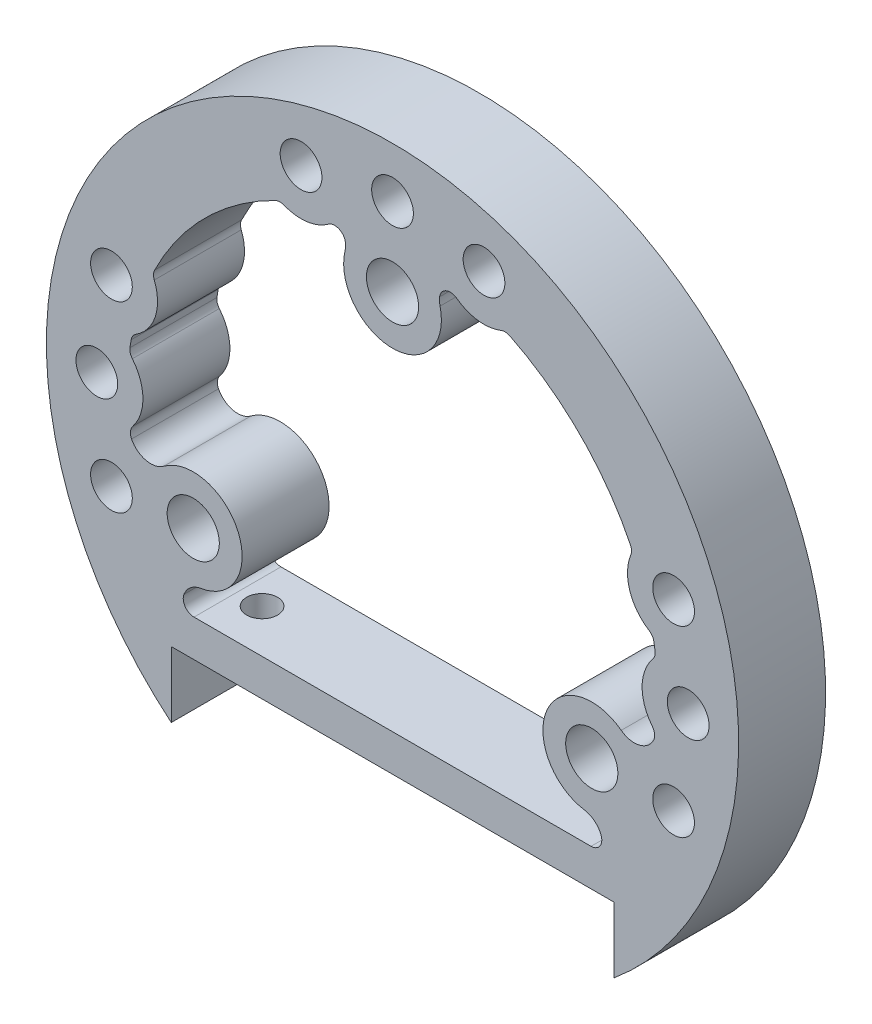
SolidWorks part; units mm, degrees
ref_plane "Front Plane" through (0, 0, 0) normal (0, 0, 1) x (1, 0, 0)
ref_plane "Top Plane" through (0, 0, 0) normal (0, 1, 0) x (1, 0, 0)
ref_plane "Right Plane" through (0, 0, 0) normal (1, 0, 0) x (0, 0, -1)
sketch "Sketch1" plane through (0, 0, 0) normal (0, 0, 1) x (1, 0, 0)
  circle A0 centre (0, 0) radius 25.273
  dimension "D1" = 50.546
extrude "Boss-Extrude1" add sketch "Sketch1" along normal blind 6.35
sketch "Sketch2" plane through (0, 0, 6.35) normal (0, 0, 1) x (1, 0, 0)
  line L0 (-15.2507, -11.938) -> (15.2507, -11.938)
  arc A0 (15.2507, -11.938) -> (-15.2507, -11.938) centre (0, 0) ccw
  dimension "D1" = 38.735
  dimension "D2" = 11.938
extrude "Cut-Extrude1" cut sketch "Sketch2" against normal through all
sketch "Sketch3" plane through (0, 0, 6.35) normal (0, 0, 1) x (1, 0, 0)
  line L0 (-15.2507, -11.938) -> (15.2507, -11.938) construction
  line L1 (-16.1544, -33.6804) -> (16.1544, -33.6804)
  line L2 (-16.1544, -33.6804) -> (-16.1544, -14.6304)
  line L3 (-16.1544, -14.6304) -> (16.1544, -14.6304)
  line L4 (16.1544, -33.6804) -> (16.1544, -14.6304)
  dimension "D1" = 2.6924
  dimension "D2" = 32.3088
  dimension "D3" = 16.1544
  dimension "D4" = 19.05
extrude "Cut-Extrude3" cut sketch "Sketch3" against normal through all
sketch "Sketch4" plane through (0, -14.6304, 0) normal (0, -1, 0) x (1, 0, 0)
  line L0 (16.1544, 6.35) -> (-16.1544, 6.35) construction
  circle A0 centre (-12.7, 3.175) radius 1.1303
  circle A1 centre (12.7, 3.175) radius 1.1303
  dimension "D1" = 2.2606
  dimension "D2" = 2.2606
  dimension "D4" = 12.7
  dimension "D3" = 25.4
  dimension "D5" = 3.175
  dimension "D6" = 3.175
extrude "Cut-Extrude4" cut sketch "Sketch4" against normal blind 6.35
sketch "Sketch5" plane through (0, 0, 6.35) normal (0, 0, 1) x (1, 0, 0)
  circle A0 centre (-6.6802, 20.5232) radius 1.524
  circle A1 centre (6.6802, 20.5232) radius 1.524
  arc A2 (15.2507, -11.938) -> (-15.2507, -11.938) centre (0, 0) ccw construction
  circle A3 centre (-21.59, 0) radius 1.524
  circle A4 centre (21.59, 0) radius 1.524
  circle A5 centre (0, 21.59) radius 1.524
  circle A6 centre (-20.5232, 6.6802) radius 1.524
  circle A7 centre (20.5232, 6.6802) radius 1.524
  circle A8 centre (20.5232, -6.6802) radius 1.524
  circle A9 centre (-20.5232, -6.6802) radius 1.524
  dimension "D1" = 3.048
  dimension "D5" = 3.048
  dimension "D8" = 3.048
  dimension "D9" = 3.048
  dimension "D11" = 3.048
  dimension "D13" = 3.048
  dimension "D15" = 3.048
  dimension "D17" = 3.048
  dimension "D18" = 3.048
  dimension "D2" = 20.5232
  dimension "D3" = 6.6802
  dimension "D4" = 6.6802
  dimension "D6" = 21.59
  dimension "D7" = 21.59
  dimension "D10" = 21.59
  dimension "D12" = 20.5232
  dimension "D14" = 6.6802
  dimension "D16" = 20.5232
  dimension "D19" = 6.6802
  dimension "D20" = 6.6802
extrude "Cut-Extrude5" cut sketch "Sketch5" against normal through all
sketch "Sketch6" plane through (0, 0, 6.35) normal (0, 0, 1) x (1, 0, 0)
  circle A0 centre (0, 15.875) radius 3.5687
  circle A1 centre (-14.5497, -6.35) radius 3.5687
  circle A2 centre (14.5497, -6.35) radius 3.5687
  dimension "D1" = 7.1374
  dimension "D3" = 7.1374
  dimension "D4" = 7.1374
  dimension "D2" = 15.875
  dimension "D5" = 15.875
  dimension "D6" = 15.875
  dimension "D7" = 6.35
  dimension "D8" = 6.35
extrude "Boss-Extrude2" add sketch "Sketch6" against normal blind 6.35
fillet "Fillet1" radius 1.5748 6 edges at (-0.81, 19.3506, 3.175) (0.81, 19.3506, 3.175) (18.0591, -6.9978, 3.175) (17.4111, -8.4826, 3.175) (-17.4111, -8.4826, 3.175) (-18.0591, -6.9978, 3.175)
sketch "Sketch8" plane through (0, 0, 6.35) normal (0, 0, 1) x (1, 0, 0)
  circle A0 centre (0, 15.875) radius 1.905
  circle A1 centre (-14.5497, -6.35) radius 1.905
  circle A2 centre (14.5497, -6.35) radius 1.905
  dimension "D1" = 3.81
  dimension "D2" = 3.81
  dimension "D3" = 3.81
extrude "Cut-Extrude6" cut sketch "Sketch8" against normal through all
sketch "Sketch10" plane through (0, 0, 6.35) normal (0, 0, 1) x (1, 0, 0)
  circle A0 centre (-20.5232, 6.6802) radius 1.524
  circle A1 centre (-20.5232, 6.6802) radius 3.3655
  circle A2 centre (-21.59, 0) radius 1.524
  circle A3 centre (-21.59, 0) radius 3.3655
  circle A4 centre (-6.6802, 20.5232) radius 1.524
  circle A5 centre (-6.6802, 20.5232) radius 3.3655
  circle A6 centre (6.6802, 20.5232) radius 1.524
  circle A7 centre (6.6802, 20.5232) radius 3.3655
  circle A8 centre (20.5232, 6.6802) radius 1.524
  circle A9 centre (20.5232, 6.6802) radius 3.3655
  circle A10 centre (21.59, 0) radius 1.524
  circle A11 centre (21.59, 0) radius 3.3655
  dimension "D1" = 3.048
  dimension "D2" = 6.731
  dimension "D3" = 3.048
  dimension "D4" = 6.731
  dimension "D5" = 3.048
  dimension "D6" = 6.731
  dimension "D7" = 3.048
  dimension "D8" = 6.731
  dimension "D9" = 3.048
  dimension "D10" = 6.731
  dimension "D11" = 3.048
  dimension "D12" = 6.731
extrude "Boss-Extrude4" add sketch "Sketch10" against normal blind 6.35
fillet "Fillet2" radius 0.7874 14 edges at (19.2196, 2.3891, 3.175) (19.2196, -2.3891, 3.175) (17.5337, 8.2261, 3.175) (19.0164, 3.6708, 3.175) (8.2261, 17.5337, 3.175) (4.0978, 18.365, 3.175) (-4.0978, 18.365, 3.175) (-8.2261, 17.5337, 3.175) (-19.2196, -2.3891, 3.175) (-19.2196, 2.3891, 3.175) (-19.0164, 3.6708, 3.175) (-17.5337, 8.2261, 3.175) (15.2507, -11.938, 3.175) (-15.2507, -11.938, 3.175)
chamfer "Chamfer1" distance 1.778 angle 41 6 edges at (22.0472, 6.6802, 0) (23.114, 0, 0) (-20.066, 0, 0) (-18.9992, 6.6802, 0) (-5.1562, 20.5232, 0) (8.2042, 20.5232, 0)
